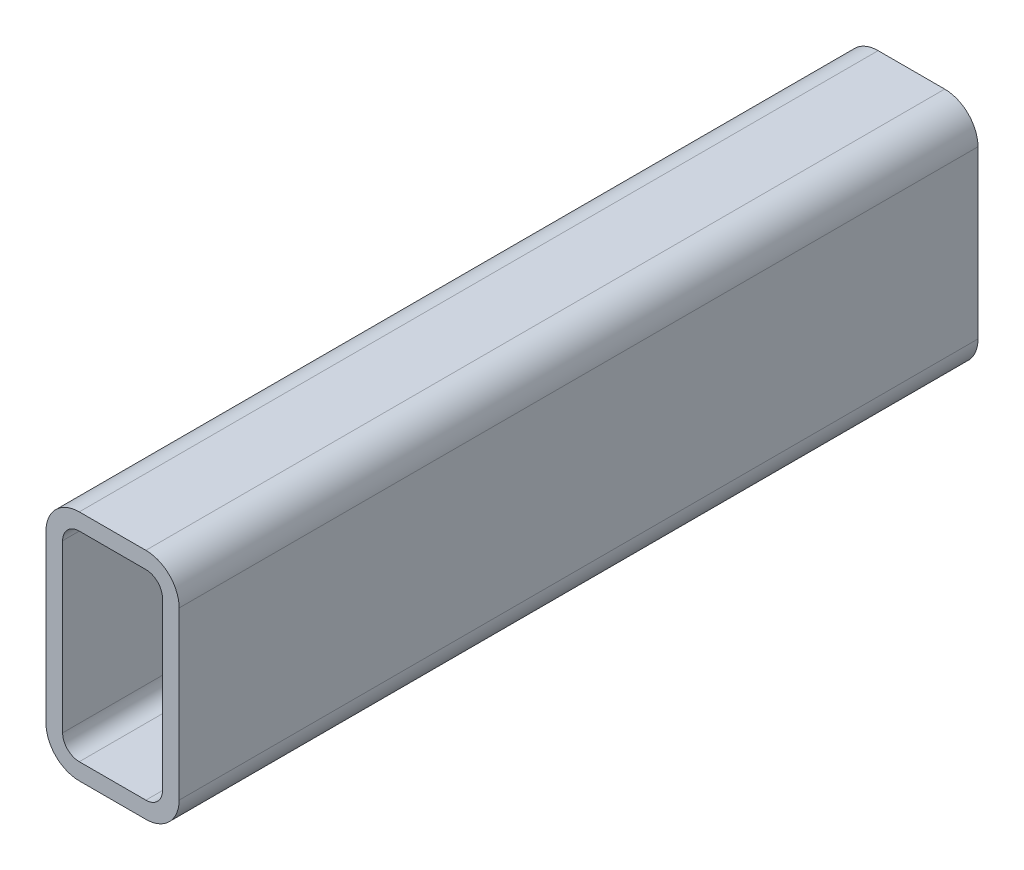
SolidWorks part; units mm, degrees
ref_plane "Front Plane" through (0, 0, 0) normal (0, 0, 1) x (1, 0, 0)
ref_plane "Top Plane" through (0, 0, 0) normal (0, 1, 0) x (1, 0, 0)
ref_plane "Right Plane" through (0, 0, 0) normal (1, 0, 0) x (0, 0, -1)
sketch "Sketch1" plane through (0, 0, 0) normal (0, 0, 1) x (1, 0, 0)
  line B0 (12.7, 88.9) -> (38.1, 88.9)
  arc B1 (50.8, 76.2) -> (38.1, 88.9) centre (38.1, 76.2) ccw
  line B2 (50.8, 76.2) -> (50.8, 12.7)
  arc B3 (38.1, 0) -> (50.8, 12.7) centre (38.1, 12.7) ccw
  line B4 (38.1, 0) -> (12.7, 0)
  arc B5 (0, 12.7) -> (12.7, 0) centre (12.7, 12.7) ccw
  line B6 (0, 12.7) -> (0, 76.2)
  arc B7 (12.7, 88.9) -> (0, 76.2) centre (12.7, 76.2) ccw
  line B8 (12.7, 82.55) -> (38.1, 82.55)
  arc B9 (44.45, 76.2) -> (38.1, 82.55) centre (38.1, 76.2) ccw
  line B10 (44.45, 76.2) -> (44.45, 12.7)
  arc B11 (38.1, 6.35) -> (44.45, 12.7) centre (38.1, 12.7) ccw
  line B12 (38.1, 6.35) -> (12.7, 6.35)
  arc B13 (6.35, 12.7) -> (12.7, 6.35) centre (12.7, 12.7) ccw
  line B14 (6.35, 12.7) -> (6.35, 76.2)
  arc B15 (12.7, 82.55) -> (6.35, 76.2) centre (12.7, 76.2) ccw
sketch_block_instance "HSS3.5x2x0.250-1"
sketch_block "HSS3.5x2x0.250"
extrude "Boss-Extrude1" add sketch "Sketch1" along normal blind 304.8
